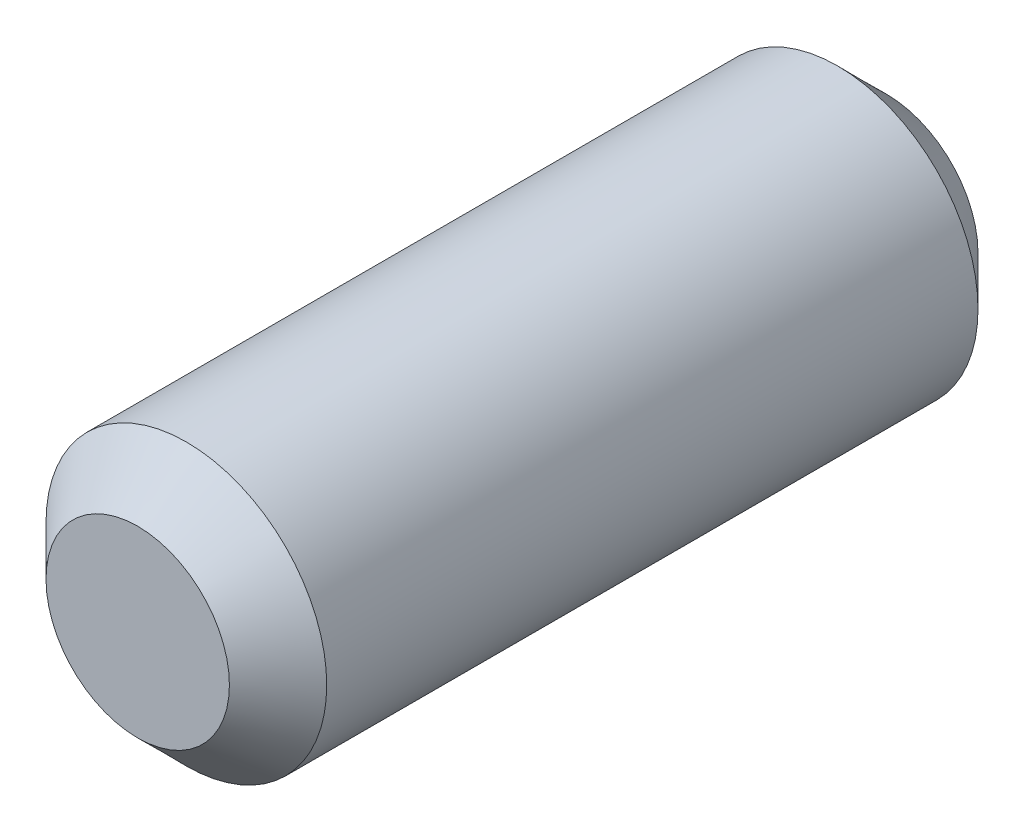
SolidWorks part; units mm, degrees
ref_plane "Front Plane" through (0, 0, 0) normal (0, 0, 1) x (1, 0, 0)
ref_plane "Top Plane" through (0, 0, 0) normal (0, 1, 0) x (1, 0, 0)
ref_plane "Right Plane" through (0, 0, 0) normal (1, 0, 0) x (0, 0, -1)
sketch "Sketch1" plane through (0, 0, 0) normal (0, 0, 1) x (1, 0, 0)
  circle A0 centre (0, 0) radius 2.3812
  dimension "D1" = 4.7625
extrude "Extrude1" add sketch "Sketch1" along normal mid plane 12.7
chamfer "Chamfer1" distance 0.8255 angle 45 2 edges at (2.3812, 0, -6.35) (2.3812, 0, 6.35)
